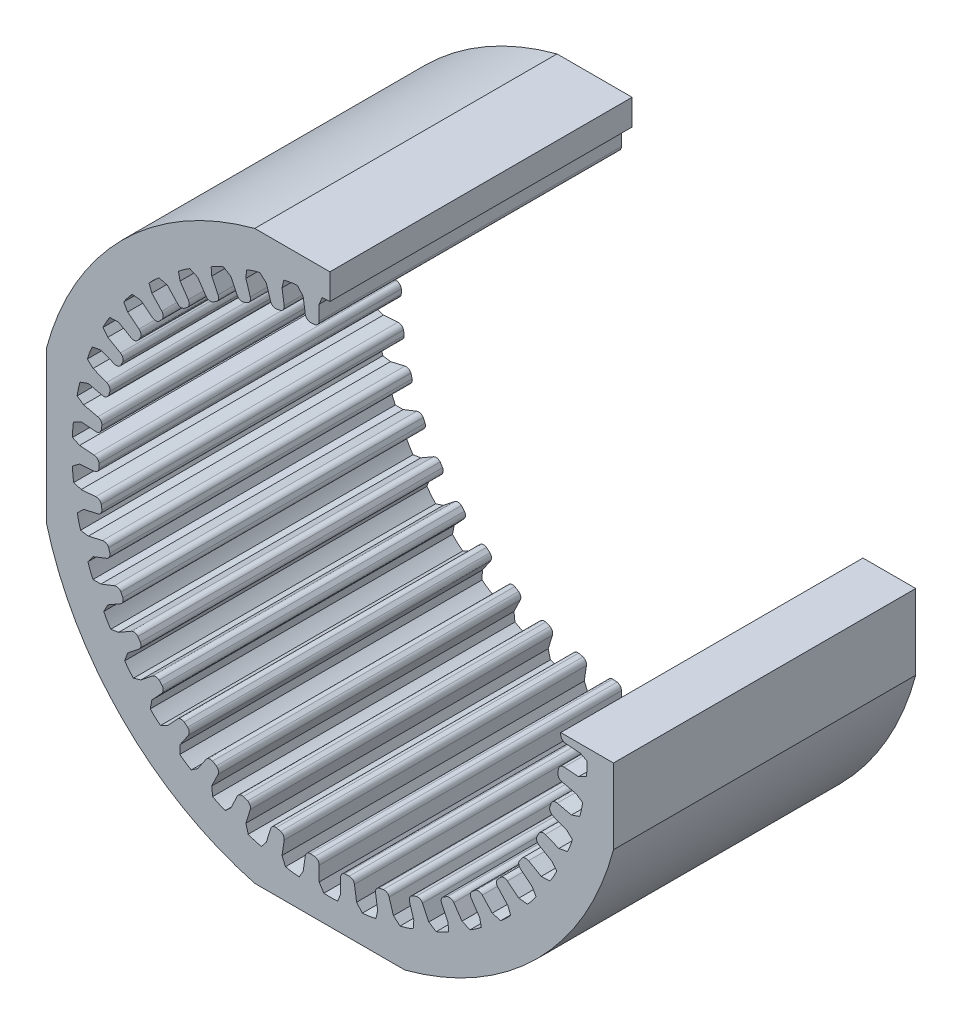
SolidWorks part; units mm, degrees
ref_plane "Plan de face" through (0, 0, 0) normal (0, 0, 1) x (1, 0, 0)
ref_plane "Plan de dessus" through (0, 0, 0) normal (0, 1, 0) x (1, 0, 0)
ref_plane "Plan de droite" through (0, 0, 0) normal (1, 0, 0) x (0, 0, -1)
sketch "Esquisse2" plane through (0, 0, 0) normal (0, 0, 1) x (1, 0, 0)
  line L0 (-28.1926, 15.95) -> (-15.95, 15.95)
  line L1 (-15.95, 18.2904) -> (-15.95, 15.95)
  line L2 (0, 0) -> (0, 12.7931) construction
  line L3 (0, 0) -> (11.1029, 0) construction
  line L5 (15.95, 4.2246) -> (15.95, -4.2246)
  line L6 (-4.2246, 15.95) -> (4.2246, 15.95)
  line L8 (-15.95, 4.2246) -> (-15.95, -4.2246)
  line L9 (-4.2246, -15.95) -> (4.2246, -15.95)
  arc A0 (-4.2246, 15.95) -> (-15.95, 4.2246) centre (0, 0) ccw
  arc A1 (-15.95, -4.2246) -> (-4.2246, -15.95) centre (0, 0) ccw
  arc A2 (4.2246, -15.95) -> (15.95, -4.2246) centre (0, 0) ccw
  arc A3 (15.95, 4.2246) -> (4.2246, 15.95) centre (0, 0) ccw
  dimension "D1" = 33
  dimension "D2" = 15.95
  dimension "D3" = 15.95
extrude "Extrusion1" add sketch "Esquisse2" along normal blind 17 contours L5 A3 L6 A0 L8 A1 L9 A2
sketch "Esquisse3" plane through (0, 0, 17) normal (0, 0, 1) x (1, 0, 0)
  line L0 (-0.4376, 14.4796) -> (-0.6, 14.071)
  line L1 (-0.6, 14.071) -> (-0.6, 13.25)
  line L2 (0.6, 14.0711) -> (0.6, 13.2527)
  line L3 (0.3385, 14.4878) -> (0.6, 14.0711)
  line L4 (0, 0) -> (0, 17.4119) construction
  line L5 (0, 14.5) -> (0, -4.5486) construction
  line L6 (1.7254, 14.3831) -> (1.5039, 14.0033)
  line L7 (1.5039, 14.0033) -> (1.3815, 13.1914)
  line L8 (2.6905, 13.8245) -> (2.5685, 13.0152)
  line L9 (2.494, 14.2755) -> (2.6905, 13.8245)
  line L10 (3.8498, 13.9653) -> (3.5742, 13.6228)
  line L11 (3.5742, 13.6228) -> (3.3322, 12.8382)
  line L12 (4.7209, 13.2691) -> (4.4796, 12.4871)
  line L13 (4.5938, 13.7444) -> (4.7209, 13.2691)
  line L14 (5.8882, 13.2355) -> (5.5646, 12.9379)
  line L15 (5.5646, 12.9379) -> (5.2084, 12.1982)
  line L16 (6.6458, 12.4173) -> (6.2907, 11.6799)
  line L17 (6.591, 12.9062) -> (6.6458, 12.4173)
  line L18 (7.7951, 12.2101) -> (7.4308, 11.964)
  line L19 (7.4308, 11.964) -> (6.9682, 11.2857)
  line L20 (8.4223, 11.2881) -> (7.9612, 10.6119)
  line L21 (8.4409, 11.7797) -> (8.4223, 11.2881)
  line L22 (9.5279, 10.9119) -> (9.1309, 10.7229)
  line L23 (9.1309, 10.7229) -> (8.5725, 10.121)
  line L24 (10.0106, 9.9067) -> (9.4539, 9.3068)
  line L25 (10.1023, 10.3901) -> (10.0106, 9.9067)
  line L26 (11.0478, 9.37) -> (10.6271, 9.2422)
  line L27 (10.6271, 9.2422) -> (9.9852, 8.7303)
  line L28 (11.3753, 8.3041) -> (10.7355, 7.7938)
  line L29 (11.538, 8.7684) -> (11.3753, 8.3041)
  line L30 (12.3209, 7.6187) -> (11.8859, 7.5551)
  line L31 (11.8859, 7.5551) -> (11.1748, 7.1446)
  line L32 (12.4859, 6.5159) -> (11.7772, 6.1067)
  line L33 (12.716, 6.9508) -> (12.4859, 6.5159)
  line L34 (13.3188, 5.6973) -> (12.8792, 5.6993)
  line L35 (12.8792, 5.6993) -> (12.1149, 5.3993)
  line L36 (13.3176, 4.5822) -> (12.5558, 4.2832)
  line L37 (13.61, 4.9779) -> (13.3176, 4.5822)
  line L38 (14.0192, 3.6486) -> (13.5847, 3.7161)
  line L39 (13.5847, 3.7161) -> (12.7843, 3.5334)
  line L40 (13.8518, 2.5461) -> (13.0539, 2.364)
  line L41 (14.1999, 2.8939) -> (13.8518, 2.5461)
  line L42 (14.4064, 1.5184) -> (13.9869, 1.6499)
  line L43 (13.9869, 1.6499) -> (13.1681, 1.5885)
  line L44 (14.0765, 0.4532) -> (13.2605, 0.3921)
  line L45 (14.4726, 0.7451) -> (14.0765, 0.4532)
  line L46 (14.4718, -0.6457) -> (14.0765, -0.4532)
  line L47 (14.0765, -0.4532) -> (13.2578, -0.3919)
  line L48 (13.9869, -1.6499) -> (13.1708, -1.5887)
  line L49 (14.422, -1.4202) -> (13.9869, -1.6499)
  line L50 (14.2139, -2.7954) -> (13.8518, -2.5461)
  line L51 (13.8518, -2.5461) -> (13.0513, -2.3634)
  line L52 (13.5848, -3.7161) -> (12.7869, -3.534)
  line L53 (14.0492, -3.5538) -> (13.5848, -3.7161)
  line L54 (13.6385, -4.8827) -> (13.3176, -4.5822)
  line L55 (13.3176, -4.5822) -> (12.5533, -4.2822)
  line L56 (12.8792, -5.6993) -> (12.1174, -5.4003)
  line L57 (13.3627, -5.6081) -> (12.8792, -5.6993)
  line L58 (12.7585, -6.8609) -> (12.4859, -6.5159)
  line L59 (12.4859, -6.5159) -> (11.7748, -6.1054)
  line L60 (11.8859, -7.5551) -> (11.1772, -7.146)
  line L61 (12.3776, -7.537) -> (11.8859, -7.5551)
  line L62 (11.5934, -8.6858) -> (11.3753, -8.3041)
  line L63 (11.3753, -8.3041) -> (10.7334, -7.7921)
  line L64 (10.6271, -9.2423) -> (9.9873, -8.732)
  line L65 (11.116, -9.2976) -> (10.6271, -9.2423)
  line L66 (10.1694, -10.3167) -> (10.0106, -9.9067)
  line L67 (10.0106, -9.9067) -> (9.4521, -9.3048)
  line L68 (9.1309, -10.7229) -> (8.5743, -10.123)
  line L69 (9.6061, -10.8505) -> (9.1309, -10.7229)
  line L70 (8.5182, -11.7171) -> (8.4222, -11.288)
  line L71 (8.4222, -11.288) -> (7.9597, -10.6097)
  line L72 (7.4308, -11.964) -> (6.9698, -11.2879)
  line L73 (7.8816, -12.161) -> (7.4308, -11.964)
  line L74 (6.6767, -12.8558) -> (6.6458, -12.4172)
  line L75 (6.6458, -12.4172) -> (6.2895, -11.6775)
  line L76 (5.5646, -12.9379) -> (5.2095, -12.2006)
  line L77 (5.9811, -13.1999) -> (5.5646, -12.9379)
  line L78 (4.6861, -13.7073) -> (4.7209, -13.2691)
  line L79 (4.7209, -13.2691) -> (4.4788, -12.4845)
  line L80 (3.5742, -13.6228) -> (3.333, -12.8408)
  line L81 (3.9469, -13.9439) -> (3.5742, -13.6228)
  line L82 (2.5907, -14.2526) -> (2.6905, -13.8245)
  line L83 (2.6905, -13.8245) -> (2.5681, -13.0126)
  line L84 (1.5039, -14.0033) -> (1.3819, -13.1941)
  line L85 (1.8246, -14.3764) -> (1.5039, -14.0033)
  line L86 (0.4376, -14.4796) -> (0.6, -14.071)
  line L87 (0.6, -14.071) -> (0.6, -13.25)
  line L88 (-0.6, -14.0711) -> (-0.6, -13.2527)
  line L89 (-0.3385, -14.4878) -> (-0.6, -14.0711)
  line L90 (-1.7254, -14.3831) -> (-1.5039, -14.0033)
  line L91 (-1.5039, -14.0033) -> (-1.3815, -13.1914)
  line L92 (-2.6905, -13.8245) -> (-2.5685, -13.0152)
  line L93 (-2.494, -14.2755) -> (-2.6905, -13.8245)
  line L94 (-3.8498, -13.9653) -> (-3.5742, -13.6228)
  line L95 (-3.5742, -13.6228) -> (-3.3322, -12.8382)
  line L96 (-4.7209, -13.2691) -> (-4.4796, -12.4871)
  line L97 (-4.5938, -13.7444) -> (-4.7209, -13.2691)
  line L98 (-5.8882, -13.2355) -> (-5.5646, -12.9379)
  line L99 (-5.5646, -12.9379) -> (-5.2084, -12.1982)
  line L100 (-6.6458, -12.4173) -> (-6.2907, -11.6799)
  line L101 (-6.591, -12.9062) -> (-6.6458, -12.4173)
  line L102 (-7.7951, -12.2101) -> (-7.4308, -11.964)
  line L103 (-7.4308, -11.964) -> (-6.9682, -11.2857)
  line L104 (-8.4223, -11.2881) -> (-7.9612, -10.6119)
  line L105 (-8.4409, -11.7797) -> (-8.4223, -11.2881)
  line L106 (-9.5279, -10.9119) -> (-9.1309, -10.7229)
  line L107 (-9.1309, -10.7229) -> (-8.5725, -10.121)
  line L108 (-10.0106, -9.9067) -> (-9.4539, -9.3068)
  line L109 (-10.1023, -10.3901) -> (-10.0106, -9.9067)
  line L110 (-11.0478, -9.37) -> (-10.6271, -9.2422)
  line L111 (-10.6271, -9.2422) -> (-9.9852, -8.7303)
  line L112 (-11.3753, -8.3041) -> (-10.7355, -7.7938)
  line L113 (-11.538, -8.7684) -> (-11.3753, -8.3041)
  line L114 (-12.3209, -7.6187) -> (-11.8859, -7.5551)
  line L115 (-11.8859, -7.5551) -> (-11.1748, -7.1446)
  line L116 (-12.4859, -6.5159) -> (-11.7772, -6.1067)
  line L117 (-12.716, -6.9508) -> (-12.4859, -6.5159)
  line L118 (-13.3188, -5.6973) -> (-12.8792, -5.6993)
  line L119 (-12.8792, -5.6993) -> (-12.1149, -5.3993)
  line L120 (-13.3176, -4.5822) -> (-12.5558, -4.2832)
  line L121 (-13.61, -4.9779) -> (-13.3176, -4.5822)
  line L122 (-14.0192, -3.6486) -> (-13.5847, -3.7161)
  line L123 (-13.5847, -3.7161) -> (-12.7843, -3.5334)
  line L124 (-13.8518, -2.5461) -> (-13.0539, -2.364)
  line L125 (-14.1999, -2.8939) -> (-13.8518, -2.5461)
  line L126 (-14.4064, -1.5184) -> (-13.9869, -1.6499)
  line L127 (-13.9869, -1.6499) -> (-13.1681, -1.5885)
  line L128 (-14.0765, -0.4532) -> (-13.2605, -0.3921)
  line L129 (-14.4726, -0.7451) -> (-14.0765, -0.4532)
  line L130 (-14.4718, 0.6457) -> (-14.0765, 0.4532)
  line L131 (-14.0765, 0.4532) -> (-13.2578, 0.3919)
  line L132 (-13.9869, 1.6499) -> (-13.1708, 1.5887)
  line L133 (-14.422, 1.4202) -> (-13.9869, 1.6499)
  line L134 (-14.2139, 2.7954) -> (-13.8518, 2.5461)
  line L135 (-13.8518, 2.5461) -> (-13.0513, 2.3634)
  line L136 (-13.5848, 3.7161) -> (-12.7869, 3.534)
  line L137 (-14.0492, 3.5538) -> (-13.5848, 3.7161)
  line L138 (-13.6385, 4.8827) -> (-13.3176, 4.5822)
  line L139 (-13.3176, 4.5822) -> (-12.5533, 4.2822)
  line L140 (-12.8792, 5.6993) -> (-12.1174, 5.4003)
  line L141 (-13.3627, 5.6081) -> (-12.8792, 5.6993)
  line L142 (-12.7585, 6.8609) -> (-12.4859, 6.5159)
  line L143 (-12.4859, 6.5159) -> (-11.7748, 6.1054)
  line L144 (-11.8859, 7.5551) -> (-11.1772, 7.146)
  line L145 (-12.3776, 7.537) -> (-11.8859, 7.5551)
  line L146 (-11.5934, 8.6858) -> (-11.3753, 8.3041)
  line L147 (-11.3753, 8.3041) -> (-10.7334, 7.7921)
  line L148 (-10.6271, 9.2423) -> (-9.9873, 8.732)
  line L149 (-11.116, 9.2976) -> (-10.6271, 9.2423)
  line L150 (-10.1694, 10.3167) -> (-10.0106, 9.9067)
  line L151 (-10.0106, 9.9067) -> (-9.4521, 9.3048)
  line L152 (-9.1309, 10.7229) -> (-8.5743, 10.123)
  line L153 (-9.6061, 10.8505) -> (-9.1309, 10.7229)
  line L154 (-8.5182, 11.7171) -> (-8.4222, 11.288)
  line L155 (-8.4222, 11.288) -> (-7.9597, 10.6097)
  line L156 (-7.4308, 11.964) -> (-6.9698, 11.2879)
  line L157 (-7.8816, 12.161) -> (-7.4308, 11.964)
  line L158 (-6.6767, 12.8558) -> (-6.6458, 12.4172)
  line L159 (-6.6458, 12.4172) -> (-6.2895, 11.6775)
  line L160 (-5.5646, 12.9379) -> (-5.2095, 12.2006)
  line L161 (-5.9811, 13.1999) -> (-5.5646, 12.9379)
  line L162 (-4.6861, 13.7073) -> (-4.7209, 13.2691)
  line L163 (-4.7209, 13.2691) -> (-4.4788, 12.4845)
  line L164 (-3.5742, 13.6228) -> (-3.333, 12.8408)
  line L165 (-3.9469, 13.9439) -> (-3.5742, 13.6228)
  line L166 (-2.5907, 14.2526) -> (-2.6905, 13.8245)
  line L167 (-2.6905, 13.8245) -> (-2.5681, 13.0126)
  line L168 (-1.5039, 14.0033) -> (-1.3819, 13.1941)
  line L169 (-1.8246, 14.3764) -> (-1.5039, 14.0033)
  line L170 (0.8462, 12.9578) -> (1.0982, 12.9364)
  line L171 (2.768, 12.6869) -> (3.014, 12.6283)
  line L172 (4.628, 12.1327) -> (4.8625, 12.038)
  line L173 (6.3846, 11.3074) -> (6.6023, 11.1789)
  line L174 (7.9985, 10.2295) -> (8.1947, 10.07)
  line L175 (9.4338, 8.9232) -> (9.604, 8.7361)
  line L176 (10.6584, 7.4175) -> (10.7988, 7.2072)
  line L177 (11.6448, 5.7461) -> (11.7524, 5.5172)
  line L178 (12.3712, 3.9463) -> (12.4434, 3.704)
  line L179 (12.8212, 2.0584) -> (12.8565, 1.808)
  line L180 (12.9848, 0.1245) -> (12.9823, -0.1284)
  line L181 (12.8583, -1.8122) -> (12.8182, -2.0618)
  line L182 (12.4446, -3.7083) -> (12.3677, -3.9493)
  line L183 (11.7529, -5.5217) -> (11.641, -5.7485)
  line L184 (10.7987, -7.2117) -> (10.6542, -7.4193)
  line L185 (9.6032, -8.7406) -> (9.4294, -8.9243)
  line L186 (8.1932, -10.0743) -> (7.994, -10.23)
  line L187 (6.6002, -11.1829) -> (6.38, -11.3072)
  line L188 (4.8598, -12.0417) -> (4.6235, -12.1318)
  line L189 (3.0108, -12.6315) -> (2.7637, -12.6854)
  line L190 (1.0945, -12.9391) -> (0.8422, -12.9556)
  line L191 (-0.8462, -12.9578) -> (-1.0982, -12.9364)
  line L192 (-2.768, -12.6869) -> (-3.014, -12.6283)
  line L193 (-4.628, -12.1327) -> (-4.8625, -12.038)
  line L194 (-6.3846, -11.3074) -> (-6.6023, -11.1789)
  line L195 (-7.9985, -10.2295) -> (-8.1947, -10.07)
  line L196 (-9.4338, -8.9232) -> (-9.604, -8.7361)
  line L197 (-10.6584, -7.4175) -> (-10.7988, -7.2072)
  line L198 (-11.6448, -5.7461) -> (-11.7524, -5.5172)
  line L199 (-12.3712, -3.9463) -> (-12.4434, -3.704)
  line L200 (-12.8212, -2.0584) -> (-12.8565, -1.808)
  line L201 (-12.9848, -0.1245) -> (-12.9823, 0.1284)
  line L202 (-12.8583, 1.8122) -> (-12.8182, 2.0618)
  line L203 (-12.4446, 3.7083) -> (-12.3677, 3.9493)
  line L204 (-11.7529, 5.5217) -> (-11.641, 5.7485)
  line L205 (-10.7987, 7.2117) -> (-10.6542, 7.4193)
  line L206 (-9.6032, 8.7406) -> (-9.4294, 8.9243)
  line L207 (-8.1932, 10.0743) -> (-7.994, 10.23)
  line L208 (-6.6002, 11.1829) -> (-6.38, 11.3072)
  line L209 (-4.8598, 12.0417) -> (-4.6235, 12.1318)
  line L210 (-3.0108, 12.6315) -> (-2.7637, 12.6854)
  line L211 (-1.0945, 12.9391) -> (-0.8422, 12.9556)
  arc A0 (1.3815, 13.1914) -> (1.0982, 12.9364) centre (1.0849, 13.2361) cw
  arc A1 (-0.6, 13.25) -> (-0.8422, 12.9556) centre (-0.9, 13.25) cw
  arc A2 (0.6, 13.2527) -> (0.8462, 12.9578) centre (0.9, 13.2529) ccw
  arc A3 (2.5685, 13.0152) -> (2.768, 12.6869) centre (2.8652, 12.9707) ccw
  arc A4 (2.494, 14.2755) -> (1.7254, 14.3831) centre (1.4606, 9.6905) ccw
  arc A5 (3.3322, 12.8382) -> (3.014, 12.6283) centre (3.0455, 12.9266) cw
  arc A6 (0.3385, 14.4878) -> (-0.4376, 14.4796) centre (0, 9.8) ccw
  arc A7 (4.4796, 12.4871) -> (4.628, 12.1327) centre (4.7664, 12.3988) ccw
  arc A8 (4.5938, 13.7444) -> (3.8498, 13.9653) centre (2.8886, 9.3646) ccw
  arc A9 (5.2084, 12.1982) -> (4.8625, 12.038) centre (4.9381, 12.3283) cw
  arc A10 (6.2907, 11.6799) -> (6.3846, 11.3074) centre (6.5611, 11.5499) ccw
  arc A11 (6.591, 12.9062) -> (5.8882, 13.2355) centre (4.2521, 8.8295) ccw
  arc A12 (6.9682, 11.2857) -> (6.6023, 11.1789) centre (6.7204, 11.4547) cw
  arc A13 (7.9612, 10.6119) -> (7.9985, 10.2295) centre (8.2092, 10.4431) ccw
  arc A14 (8.4409, 11.7797) -> (7.7951, 12.2101) centre (5.5205, 8.0971) ccw
  arc A15 (8.5725, 10.121) -> (8.1947, 10.07) centre (8.3525, 10.3251) cw
  arc A16 (9.4539, 9.3068) -> (9.4338, 8.9232) centre (9.674, 9.1029) ccw
  arc A17 (10.1023, 10.3901) -> (9.5279, 10.9119) centre (6.6657, 7.1839) ccw
  arc A18 (9.9852, 8.7303) -> (9.604, 8.7361) centre (9.7981, 8.9649) cw
  arc A19 (10.7355, 7.7938) -> (10.6584, 7.4175) centre (10.9227, 7.5594) ccw
  arc A20 (11.538, 8.7684) -> (11.0478, 9.37) centre (7.6619, 6.1102) ccw
  arc A21 (11.1748, 7.1446) -> (10.7988, 7.2072) centre (11.0248, 7.4044) cw
  arc A22 (11.7772, 6.1067) -> (11.6448, 5.7461) centre (11.9273, 5.847) ccw
  arc A23 (12.716, 6.9508) -> (12.3209, 7.6187) centre (8.487, 4.9) ccw
  arc A24 (12.1149, 5.3993) -> (11.7524, 5.5172) centre (12.0053, 5.6786) cw
  arc A25 (12.5558, 4.2832) -> (12.3712, 3.9463) centre (12.6656, 4.004) ccw
  arc A26 (13.61, 4.9779) -> (13.3188, 5.6973) centre (9.1226, 3.5803) ccw
  arc A27 (12.7843, 3.5334) -> (12.4434, 3.704) centre (12.7175, 3.8258) cw
  arc A28 (13.0539, 2.364) -> (12.8212, 2.0584) centre (13.1209, 2.0716) ccw
  arc A29 (14.1999, 2.8939) -> (14.0192, 3.6486) centre (9.5543, 2.1807) ccw
  arc A30 (13.1681, 1.5885) -> (12.8565, 1.808) centre (13.1457, 1.8877) cw
  arc A31 (13.2605, 0.3921) -> (12.9848, 0.1245) centre (13.2831, 0.0929) ccw
  arc A32 (14.4726, 0.7451) -> (14.4064, 1.5184) centre (9.7726, 0.7324) ccw
  arc A33 (13.2578, -0.3919) -> (12.9823, -0.1284) centre (13.2802, -0.0927) cw
  arc A34 (13.1708, -1.5887) -> (12.8583, -1.8122) centre (13.1486, -1.8879) ccw
  arc A35 (14.422, -1.4202) -> (14.4718, -0.6457) centre (9.7726, -0.7324) ccw
  arc A36 (13.0513, -2.3634) -> (12.8182, -2.0618) centre (13.1181, -2.071) cw
  arc A37 (12.7869, -3.534) -> (12.4446, -3.7083) centre (12.7203, -3.8265) ccw
  arc A38 (14.0492, -3.5538) -> (14.2139, -2.7954) centre (9.5543, -2.1807) ccw
  arc A39 (12.5533, -4.2822) -> (12.3677, -3.9493) centre (12.6629, -4.003) cw
  arc A40 (12.1174, -5.4003) -> (11.7529, -5.5217) centre (12.008, -5.6796) ccw
  arc A41 (13.3627, -5.6081) -> (13.6385, -4.8827) centre (9.1226, -3.5803) ccw
  arc A42 (11.7748, -6.1054) -> (11.641, -5.7485) centre (11.9248, -5.8456) cw
  arc A43 (11.1772, -7.146) -> (10.7987, -7.2117) centre (11.0273, -7.4059) ccw
  arc A44 (12.3776, -7.537) -> (12.7585, -6.8609) centre (8.487, -4.9) ccw
  arc A45 (10.7334, -7.7921) -> (10.6542, -7.4193) centre (10.9204, -7.5576) cw
  arc A46 (9.9873, -8.732) -> (9.6032, -8.7406) centre (9.8004, -8.9667) ccw
  arc A47 (11.116, -9.2976) -> (11.5934, -8.6858) centre (7.6619, -6.1102) ccw
  arc A48 (9.4521, -9.3048) -> (9.4294, -8.9243) centre (9.672, -9.1008) cw
  arc A49 (8.5743, -10.123) -> (8.1932, -10.0743) centre (8.3545, -10.3272) ccw
  arc A50 (9.6061, -10.8505) -> (10.1694, -10.3167) centre (6.6657, -7.1839) ccw
  arc A51 (7.9597, -10.6097) -> (7.994, -10.23) centre (8.2076, -10.4407) cw
  arc A52 (6.9698, -11.2879) -> (6.6002, -11.1829) centre (6.722, -11.457) ccw
  arc A53 (7.8816, -12.161) -> (8.5182, -11.7171) centre (5.5205, -8.0971) ccw
  arc A54 (6.2895, -11.6775) -> (6.38, -11.3072) centre (6.5598, -11.5473) cw
  arc A55 (5.2095, -12.2006) -> (4.8598, -12.0417) centre (4.9393, -12.3309) ccw
  arc A56 (5.9811, -13.1999) -> (6.6767, -12.8558) centre (4.2521, -8.8295) ccw
  arc A57 (4.4788, -12.4845) -> (4.6235, -12.1318) centre (4.7655, -12.3961) cw
  arc A58 (3.333, -12.8408) -> (3.0108, -12.6315) centre (3.0463, -12.9294) ccw
  arc A59 (3.9469, -13.9439) -> (4.6861, -13.7073) centre (2.8886, -9.3646) ccw
  arc A60 (2.5681, -13.0126) -> (2.7637, -12.6854) centre (2.8648, -12.9679) cw
  arc A61 (1.3819, -13.1941) -> (1.0945, -12.9391) centre (1.0853, -13.239) ccw
  arc A62 (1.8246, -14.3764) -> (2.5907, -14.2526) centre (1.4606, -9.6905) ccw
  arc A63 (0.6, -13.25) -> (0.8422, -12.9556) centre (0.9, -13.25) cw
  arc A64 (-0.6, -13.2527) -> (-0.8462, -12.9578) centre (-0.9, -13.2529) ccw
  arc A65 (-0.3385, -14.4878) -> (0.4376, -14.4796) centre (0, -9.8) ccw
  arc A66 (-1.3815, -13.1914) -> (-1.0982, -12.9364) centre (-1.0849, -13.2361) cw
  arc A67 (-2.5685, -13.0152) -> (-2.768, -12.6869) centre (-2.8652, -12.9707) ccw
  arc A68 (-2.494, -14.2755) -> (-1.7254, -14.3831) centre (-1.4606, -9.6905) ccw
  arc A69 (-3.3322, -12.8382) -> (-3.014, -12.6283) centre (-3.0455, -12.9266) cw
  arc A70 (-4.4796, -12.4871) -> (-4.628, -12.1327) centre (-4.7664, -12.3988) ccw
  arc A71 (-4.5938, -13.7444) -> (-3.8498, -13.9653) centre (-2.8886, -9.3646) ccw
  arc A72 (-5.2084, -12.1982) -> (-4.8625, -12.038) centre (-4.9381, -12.3283) cw
  arc A73 (-6.2907, -11.6799) -> (-6.3846, -11.3074) centre (-6.5611, -11.5499) ccw
  arc A74 (-6.591, -12.9062) -> (-5.8882, -13.2355) centre (-4.2521, -8.8295) ccw
  arc A75 (-6.9682, -11.2857) -> (-6.6023, -11.1789) centre (-6.7204, -11.4547) cw
  arc A76 (-7.9612, -10.6119) -> (-7.9985, -10.2295) centre (-8.2092, -10.4431) ccw
  arc A77 (-8.4409, -11.7797) -> (-7.7951, -12.2101) centre (-5.5205, -8.0971) ccw
  arc A78 (-8.5725, -10.121) -> (-8.1947, -10.07) centre (-8.3525, -10.3251) cw
  arc A79 (-9.4539, -9.3068) -> (-9.4338, -8.9232) centre (-9.674, -9.1029) ccw
  arc A80 (-10.1023, -10.3901) -> (-9.5279, -10.9119) centre (-6.6657, -7.1839) ccw
  arc A81 (-9.9852, -8.7303) -> (-9.604, -8.7361) centre (-9.7981, -8.9649) cw
  arc A82 (-10.7355, -7.7938) -> (-10.6584, -7.4175) centre (-10.9227, -7.5594) ccw
  arc A83 (-11.538, -8.7684) -> (-11.0478, -9.37) centre (-7.6619, -6.1102) ccw
  arc A84 (-11.1748, -7.1446) -> (-10.7988, -7.2072) centre (-11.0248, -7.4044) cw
  arc A85 (-11.7772, -6.1067) -> (-11.6448, -5.7461) centre (-11.9273, -5.847) ccw
  arc A86 (-12.716, -6.9508) -> (-12.3209, -7.6187) centre (-8.487, -4.9) ccw
  arc A87 (-12.1149, -5.3993) -> (-11.7524, -5.5172) centre (-12.0053, -5.6786) cw
  arc A88 (-12.5558, -4.2832) -> (-12.3712, -3.9463) centre (-12.6656, -4.004) ccw
  arc A89 (-13.61, -4.9779) -> (-13.3188, -5.6973) centre (-9.1226, -3.5803) ccw
  arc A90 (-12.7843, -3.5334) -> (-12.4434, -3.704) centre (-12.7175, -3.8258) cw
  arc A91 (-13.0539, -2.364) -> (-12.8212, -2.0584) centre (-13.1209, -2.0716) ccw
  arc A92 (-14.1999, -2.8939) -> (-14.0192, -3.6486) centre (-9.5543, -2.1807) ccw
  arc A93 (-13.1681, -1.5885) -> (-12.8565, -1.808) centre (-13.1457, -1.8877) cw
  arc A94 (-13.2605, -0.3921) -> (-12.9848, -0.1245) centre (-13.2831, -0.0929) ccw
  arc A95 (-14.4726, -0.7451) -> (-14.4064, -1.5184) centre (-9.7726, -0.7324) ccw
  arc A96 (-13.2578, 0.3919) -> (-12.9823, 0.1284) centre (-13.2802, 0.0927) cw
  arc A97 (-13.1708, 1.5887) -> (-12.8583, 1.8122) centre (-13.1486, 1.8879) ccw
  arc A98 (-14.422, 1.4202) -> (-14.4718, 0.6457) centre (-9.7726, 0.7324) ccw
  arc A99 (-13.0513, 2.3634) -> (-12.8182, 2.0618) centre (-13.1181, 2.071) cw
  arc A100 (-12.7869, 3.534) -> (-12.4446, 3.7083) centre (-12.7203, 3.8265) ccw
  arc A101 (-14.0492, 3.5538) -> (-14.2139, 2.7954) centre (-9.5543, 2.1807) ccw
  arc A102 (-12.5533, 4.2822) -> (-12.3677, 3.9493) centre (-12.6629, 4.003) cw
  arc A103 (-12.1174, 5.4003) -> (-11.7529, 5.5217) centre (-12.008, 5.6796) ccw
  arc A104 (-13.3627, 5.6081) -> (-13.6385, 4.8827) centre (-9.1226, 3.5803) ccw
  arc A105 (-11.7748, 6.1054) -> (-11.641, 5.7485) centre (-11.9248, 5.8456) cw
  arc A106 (-11.1772, 7.146) -> (-10.7987, 7.2117) centre (-11.0273, 7.4059) ccw
  arc A107 (-12.3776, 7.537) -> (-12.7585, 6.8609) centre (-8.487, 4.9) ccw
  arc A108 (-10.7334, 7.7921) -> (-10.6542, 7.4193) centre (-10.9204, 7.5576) cw
  arc A109 (-9.9873, 8.732) -> (-9.6032, 8.7406) centre (-9.8004, 8.9667) ccw
  arc A110 (-11.116, 9.2976) -> (-11.5934, 8.6858) centre (-7.6619, 6.1102) ccw
  arc A111 (-9.4521, 9.3048) -> (-9.4294, 8.9243) centre (-9.672, 9.1008) cw
  arc A112 (-8.5743, 10.123) -> (-8.1932, 10.0743) centre (-8.3545, 10.3272) ccw
  arc A113 (-9.6061, 10.8505) -> (-10.1694, 10.3167) centre (-6.6657, 7.1839) ccw
  arc A114 (-7.9597, 10.6097) -> (-7.994, 10.23) centre (-8.2076, 10.4407) cw
  arc A115 (-6.9698, 11.2879) -> (-6.6002, 11.1829) centre (-6.722, 11.457) ccw
  arc A116 (-7.8816, 12.161) -> (-8.5182, 11.7171) centre (-5.5205, 8.0971) ccw
  arc A117 (-6.2895, 11.6775) -> (-6.38, 11.3072) centre (-6.5598, 11.5473) cw
  arc A118 (-5.2095, 12.2006) -> (-4.8598, 12.0417) centre (-4.9393, 12.3309) ccw
  arc A119 (-5.9811, 13.1999) -> (-6.6767, 12.8558) centre (-4.2521, 8.8295) ccw
  arc A120 (-4.4788, 12.4845) -> (-4.6235, 12.1318) centre (-4.7655, 12.3961) cw
  arc A121 (-3.333, 12.8408) -> (-3.0108, 12.6315) centre (-3.0463, 12.9294) ccw
  arc A122 (-3.9469, 13.9439) -> (-4.6861, 13.7073) centre (-2.8886, 9.3646) ccw
  arc A123 (-2.5681, 13.0126) -> (-2.7637, 12.6854) centre (-2.8648, 12.9679) cw
  arc A124 (-1.3819, 13.1941) -> (-1.0945, 12.9391) centre (-1.0853, 13.239) ccw
  arc A125 (-1.8246, 14.3764) -> (-2.5907, 14.2526) centre (-1.4606, 9.6905) ccw
  dimension "D1" = 0.3
  dimension "D6" = 0.3
  dimension "D2" = 14.5
  dimension "D3" = 0.6
  dimension "D4" = 0.6
  dimension "D5" = 4.7
  dimension "D7" = 0.8184
  dimension "D8" = 0.492
  dimension "D9" = 4.2711
  dimension "D10" = 4.271
  dimension "D11" = 0.4397
  dimension "D12" = 0.821
extrude "Enlèv. mat.-Extru.2" cut sketch "Esquisse3" against normal through all
sketch "Esquisse4" plane through (0, 0, 0) normal (1, 0, 0) x (0, 0, -1)
  line L1 (7.8438, 0) -> (-22.5465, 0)
  line L2 (7.8438, 0) -> (7.8438, 17.0002)
  line L3 (7.8438, 17.0002) -> (-22.5465, 17.0002)
  line L4 (-22.5465, 0) -> (-22.5465, 17.0002)
extrude "Enlèv. mat.-Extru.3" cut sketch "Esquisse4" along normal blind 40
